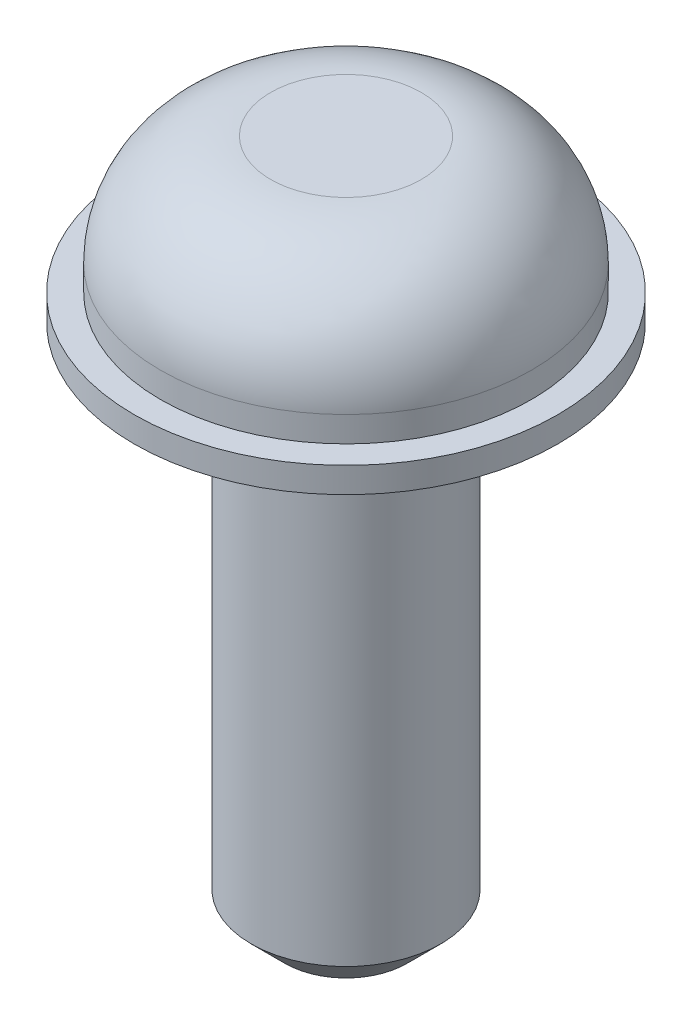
SolidWorks part; units mm, degrees
ref_plane "Front Plane" through (0, 0, 0) normal (0, 0, 1) x (1, 0, 0)
ref_plane "Top Plane" through (0, 0, 0) normal (0, 1, 0) x (1, 0, 0)
ref_plane "Right Plane" through (0, 0, 0) normal (1, 0, 0) x (0, 0, -1)
sketch "Sketch1" plane through (0, 0, 0) normal (1, 0, 0) x (0, 0, -1)
  line L0 (0, 10.7085) -> (0, -29.7766) construction
  line L1 (0, 2.413) -> (2.7813, 2.413)
  line L2 (1.4224, 0) -> (3.175, 0)
  line L3 (1.4224, 0) -> (1.4224, -7.874)
  line L4 (1.4224, -7.874) -> (0, -7.874)
  line L5 (0, -7.874) -> (0, 2.413)
  line L6 (3.175, 0) -> (3.175, 0.381)
  line L7 (3.175, 0.381) -> (2.7813, 0.381)
  line L8 (2.7813, 2.413) -> (2.7813, 0.381)
  dimension "D1" = 2.8448
  dimension "D2" = 7.874
  dimension "D3" = 6.35
  dimension "D4" = 0.381
  dimension "D5" = 5.5626
  dimension "D6" = 2.032
revolve "Revolve1" add sketch "Sketch1" angle 360 about L0
fillet "Fillet1" radius 1.651 1 edges at (0, 2.413, 2.7813)
chamfer "Chamfer1" distance 0.508 angle 45 1 edges at (0, -7.874, 1.4224)
